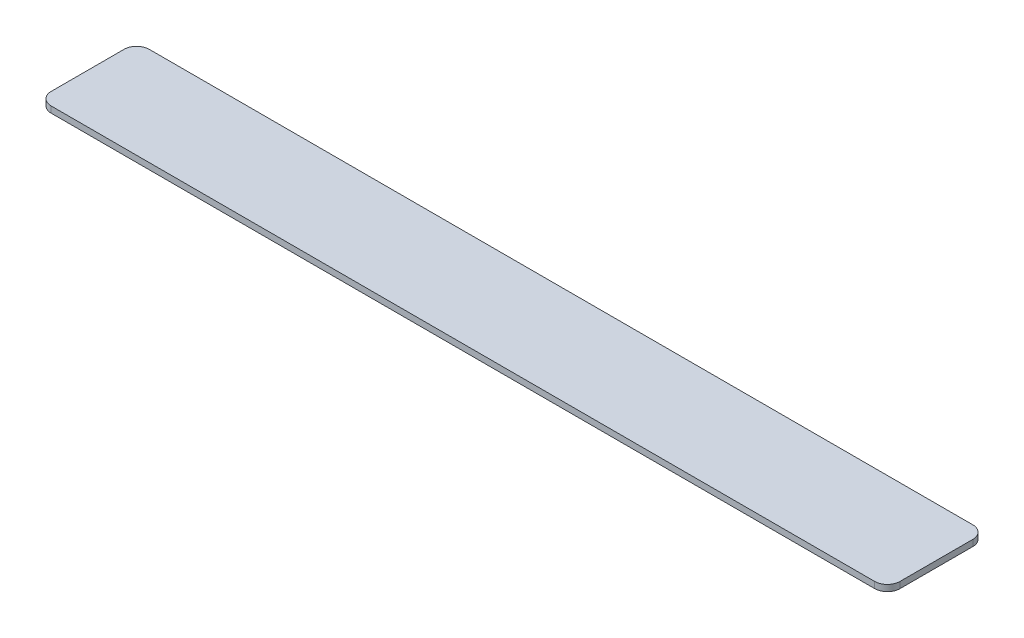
SolidWorks part; units mm, degrees
ref_plane "Front" through (0, 0, 0) normal (0, 0, 1) x (1, 0, 0)
ref_plane "Top" through (0, 0, 0) normal (0, 1, 0) x (1, 0, 0)
ref_plane "Right" through (0, 0, 0) normal (1, 0, 0) x (0, 0, -1)
sketch "Sketch1" plane through (0, 0, 0) normal (0, 1, 0) x (1, 0, 0)
  line L0 (0, 0) -> (0, 24.8412) construction
  line L1 (-214.9475, 24.8412) -> (214.9475, 24.8412)
  line L2 (-214.9475, 24.8412) -> (-214.9475, -24.8412)
  line L3 (-214.9475, -24.8412) -> (214.9475, -24.8412)
  line L4 (214.9475, 24.8412) -> (214.9475, -24.8412)
  line L5 (0, 0) -> (214.9475, 0) construction
  dimension "D1" = 429.895
  dimension "D2" = 49.6824
extrude "Extrude1" add sketch "Sketch1" along normal blind 3.175
fillet "Fillet1" radius 6.4 4 edges at (-214.9475, 1.5875, -24.8412) (-214.9475, 1.5875, 24.8412) (214.9475, 1.5875, -24.8412) (214.9475, 1.5875, 24.8412)
